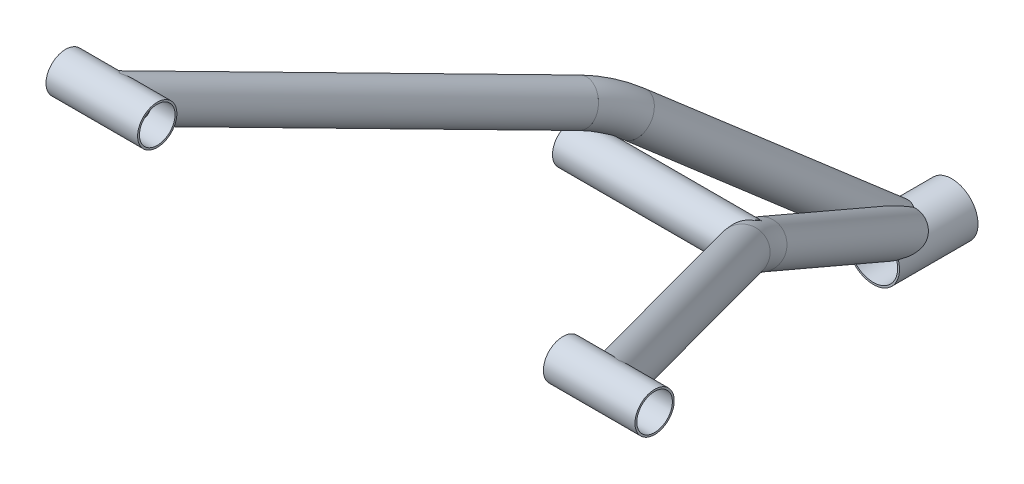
SolidWorks part; units mm, degrees
ref_plane "Front Plane" through (0, 0, 0) normal (0, 0, 1) x (1, 0, 0)
ref_plane "Top Plane" through (0, 0, 0) normal (0, 1, 0) x (1, 0, 0)
ref_plane "Right Plane" through (0, 0, 0) normal (1, 0, 0) x (0, 0, -1)
sketch "Sketch1" plane through (0, 0, 0) normal (0, 1, 0) x (1, 0, 0)
  line L0 (-142.875, 0) -> (142.875, 0) construction
  line L1 (-142.875, 0) -> (-98.425, 0)
  line L2 (142.875, 0) -> (98.425, 0)
  point P3 (120.65, 0)
  point P6 (-120.65, 0)
  dimension "D1" = 285.75
  dimension "D2" = 44.45
  dimension "D3" = 44.45
ref_plane "Plane1" through (0, 0, 0) normal (0, 0.8805, -0.4741) x (1, 0, 0)
sketch "Sketch2" plane through (0, 0, 0) normal (0, 0.8805, -0.4741) x (1, 0, 0)
  line L0 (-53.975, 0) -> (-53.975, 387.35) construction
  line L1 (-142.875, 1.1301) -> (-53.975, 1.1301) construction
  line L2 (-142.875, 0) -> (-142.875, 1.1301) construction
  line L3 (-12.7, 228.6) -> (120.65, 0)
  line L4 (-53.975, 0) -> (-53.975, 228.6) construction
  line L5 (-3.175, 228.6) -> (-98.425, 228.6)
  line L6 (142.875, 0) -> (98.425, 0) construction
  line L7 (-12.7, 228.6) -> (-98.425, 228.6)
  point P2 (-12.7, 228.6)
  dimension "D1" = 387.35
  dimension "D2" = 88.9
  dimension "D3" = 228.6
  dimension "D4" = 50.8
  dimension "D5" = 44.45
  dimension "D6" = 9.525
ref_plane "Plane2" through (0, -183.6381, 0) normal (0, 1, 0) x (1, 0, 0)
sketch "Sketch3" plane through (0, -183.6381, 0) normal (0, 1, 0) x (1, 0, 0)
  line L0 (-53.975, 341.0529) -> (-53.975, 302.9529)
  line L1 (-83.369, 322.0029) -> (-30.7181, 322.0029) construction
  point P3 (-53.975, 322.0029)
  dimension "D1" = 38.1
other "Structural Member1"
ref_plane "Plane3" through (-53.975, -183.6381, -341.0529) normal (0, 0, 1) x (1, 0, 0)
sketch "Sketch11" plane through (-53.975, -183.6381, -341.0529) normal (0, 0, 1) x (1, 0, 0)
  circle A0 centre (0, 0) radius 11.811
  circle A1 centre (0, 0) radius 12.7
  point P5 (0, 0)
  dimension "Out_dia" = 25.4
  dimension "D1" = 0.889
other "Structural Member2"
ref_plane "Plane4" through (142.875, 0, 0) normal (-1, 0, 0) x (0, 0, 1)
sketch "Sketch12" plane through (142.875, 0, 0) normal (-1, 0, 0) x (0, 0, 1)
  circle A0 centre (0, 0) radius 8.636
  circle A1 centre (0, 0) radius 9.525
  point P5 (0, 0)
  dimension "Out_dia" = 19.05
  dimension "D1" = 0.889
other "Structural Member3"
ref_plane "Plane5" through (-3.175, -108.3766, -201.2771) normal (-1, 0, 0) x (0, 0.4741, 0.8805)
sketch "Sketch13" plane through (-3.175, -108.3766, -201.2771) normal (-1, 0, 0) x (0, 0.4741, 0.8805)
  circle A0 centre (0, 0) radius 8.636
  circle A1 centre (0, 0) radius 9.525
  point P5 (0, 0)
  dimension "Out_dia" = 19.05
  dimension "D1" = 0.889
ref_plane "Plane6" through (0, -108.3766, -201.2771) normal (0, -0.4741, -0.8805) x (-1, 0, 0)
sketch "Sketch14" plane through (0, -108.3766, -201.2771) normal (0, -0.4741, -0.8805) x (-1, 0, 0)
  line L0 (53.975, 0) -> (53.975, 19.05) construction
  line L1 (3.175, 0) -> (98.425, 0) construction
  dimension "D1" = 19.05
ref_plane "Plane7" through (0, 0, 0) normal (0, 0.9168, -0.3993) x (1, 0, 0)
ref_plane "Plane8" through (0, 48.654, -40.0902) normal (0, -0.7718, 0.6359) x (-1, 0, 0)
sketch "Sketch15" plane through (0, 0, 0) normal (0, 0.9168, -0.3993) x (1, 0, 0)
  line L0 (-3.175, 227.8104) -> (-98.425, 227.8104) construction
  line L1 (-3.175, 227.8104) -> (-98.425, 227.8104) construction
  line L2 (-120.65, 0) -> (-88.9, 227.8104)
  point P3 (-88.9, 227.8104)
  point P4 (-12.7, 227.8104)
  dimension "D1" = 9.525
  dimension "D2" = 9.525
sketch "Sketch16" plane through (0, 48.654, -40.0902) normal (0, -0.7718, 0.6359) x (-1, 0, 0)
  line L0 (3.175, 219.0383) -> (98.425, 219.0383) construction
  line L1 (3.175, 219.0383) -> (98.425, 219.0383)
  line L3 (53.975, 365.2867) -> (88.9, 219.0383)
  point P0 (12.7, 219.0383)
  point P1 (88.9, 219.0383)
ref_plane "Plane9" through (0, 12.3152, -7.6774) normal (0, -0.8486, 0.529) x (-1, 0, 0)
sketch "Sketch18" plane through (0, 12.3152, -7.6774) normal (0, -0.8486, 0.529) x (-1, 0, 0)
  line L0 (12.7, 228.1389) -> (53.975, 370.4028)
sketch3d "3DSketch1"
  line L0 (120.65, 0, 0) -> (-7.0148, -103.7561, -192.696)
  line L1 (-15.8439, -114.1092, -210.4727) -> (-53.975, -183.6381, -322.0029)
  line L2 (-53.975, -183.6381, -322.0029) -> (-85.8688, -98.7079, -218.9305)
  line L3 (-90.7004, -85.4965, -197.2753) -> (-120.65, 0, 0)
  arc A0 (-7.0148, -103.7561, -192.696) -> (-15.8439, -114.1092, -210.4727) centre (67.453, -143.454, -220.6572) ccw
  arc A1 (-90.7004, -85.4965, -197.2753) -> (-85.8688, -98.7079, -218.9305) centre (-59.727, -160.1365, -160.225) ccw
  point P12 (-12.7, -108.3766, -201.2771)
  point P13 (48.7115, -214.1785, -170.1595)
  point P16 (-88.9, -90.6362, -209.1346)
  point P17 (-142.1492, -193.3957, -158.324)
  dimension "D1" = 88.9
other "Structural Member4"
ref_plane "Plane11" through (-7.0148, -103.7561, -192.696) normal (-0.5039, -0.4095, -0.7605) x (-0.0602, -0.8617, 0.5039)
sketch "Sketch19" plane through (-7.0148, -103.7561, -192.696) normal (-0.5039, -0.4095, -0.7605) x (-0.0602, -0.8617, 0.5039)
  circle A0 centre (0, 0) radius 8.636
  circle A1 centre (0, 0) radius 9.525
  point P5 (0, 0)
  dimension "Out_dia" = 19.05
  dimension "D1" = 0.889
other "Structural Member5"
ref_plane "Plane12" through (-90.7004, -85.4965, -197.2753) normal (0.138, -0.3938, -0.9088) x (0.7914, 0.5956, -0.138)
sketch "Sketch110" plane through (-90.7004, -85.4965, -197.2753) normal (0.138, -0.3938, -0.9088) x (0.7914, 0.5956, -0.138)
  circle A0 centre (0, 0) radius 8.636
  circle A1 centre (0, 0) radius 9.525
  point P5 (0, 0)
  dimension "Out_dia" = 19.05
  dimension "D1" = 0.889
other "Structural Member6"
ref_plane "Plane13" through (-90.7004, -85.4965, -197.2753) normal (-0.138, 0.3938, 0.9088) x (-0.9873, -0.1272, -0.0948)
sketch "Sketch111" plane through (-90.7004, -85.4965, -197.2753) normal (-0.138, 0.3938, 0.9088) x (-0.9873, -0.1272, -0.0948)
  circle A0 centre (0, 0) radius 8.636
  circle A1 centre (0, 0) radius 9.525
  point P5 (0, 0)
  dimension "Out_dia" = 19.05
  dimension "D1" = 0.889
delete or keep bodies "Body-Delete/Keep 1" type delete bodies bodies 104
other "Structural Member7"
ref_plane "Plane14" through (-12.7, -108.3766, -201.2771) normal (-1, 0, 0) x (0, 0.4741, 0.8805)
sketch "Sketch112" plane through (-12.7, -108.3766, -201.2771) normal (-1, 0, 0) x (0, 0.4741, 0.8805)
  circle A0 centre (0, 0) radius 8.636
  circle A1 centre (0, 0) radius 9.525
  point P5 (0, 0)
  dimension "Out_dia" = 19.05
  dimension "D1" = 0.889
sketch "Sketch113" plane through (0, 0, -341.0529) normal (0, 0, -1) x (-1, 0, 0)
  circle A0 centre (53.975, -183.6381) radius 11.811 construction
  circle A1 centre (53.975, -183.6381) radius 11.811
extrude "Cut-Extrude1" cut sketch "Sketch113" against normal through all
sketch "Sketch114" plane through (0, 0, -341.0529) normal (0, 0, -1) x (-1, 0, 0)
  circle A0 centre (53.975, -183.6381) radius 44.5906
extrude "Cut-Extrude2" cut sketch "Sketch114" along normal blind 25.4 contours A0
sketch "Sketch115" plane through (0, 0, -341.0529) normal (0, 0, -1) x (-1, 0, 0)
  line L0 (51.3821, -196.0706) -> (57.15, -206.4874)
  line L1 (57.15, -206.4874) -> (62.2632, -205.5131)
  line L2 (62.2632, -205.5131) -> (61.6897, -193.7263)
  arc A0 (61.6897, -193.7263) -> (51.3821, -196.0706) centre (53.975, -183.6381) cw
  circle A1 centre (53.975, -183.6381) radius 12.7 construction
extrude "Cut-Extrude3" cut sketch "Sketch115" against normal blind 25.4
sketch "Sketch116" plane through (142.875, 0, 0) normal (1, 0, 0) x (0, 0, -1)
  circle A0 centre (0, 0) radius 8.636 construction
  circle A1 centre (0, 0) radius 8.636
extrude "Cut-Extrude4" cut sketch "Sketch116" against normal through all
sketch "Sketch117" plane through (0, 0, -341.0529) normal (0, 0, -1) x (-1, 0, 0)
  circle A0 centre (53.975, -183.6381) radius 11.811 construction
  circle A1 centre (53.975, -183.6381) radius 11.811
extrude "Cut-Extrude5" cut sketch "Sketch117" against normal through all
sketch "Sketch118" plane through (0, 0, -341.0529) normal (0, 0, -1) x (-1, 0, 0)
  circle A0 centre (53.975, -183.6381) radius 12.7 construction
  circle A1 centre (53.975, -183.6381) radius 12.7
extrude "Cut-Extrude6" cut sketch "Sketch118" along normal blind 25.4
sketch "Sketch119" plane through (0, 0, -341.0529) normal (0, 0, -1) x (-1, 0, 0)
  line L0 (53.4058, -196.3253) -> (52.077, -206.4689)
  line L1 (52.077, -206.4689) -> (60.7412, -206.9412)
  line L2 (60.7412, -206.9412) -> (65.1105, -199.3745)
  line L3 (65.1105, -199.3745) -> (62.2809, -193.2455)
  arc A0 (62.2809, -193.2455) -> (53.4058, -196.3253) centre (53.975, -183.6381) cw
  circle A1 centre (53.975, -183.6381) radius 12.7 construction
extrude "Cut-Extrude7" cut sketch "Sketch119" against normal through all both and the other way through all
sketch "Sketch120" plane through (0, 0, -341.0529) normal (0, 0, -1) x (-1, 0, 0)
  line L0 (46.0391, -193.5533) -> (42.5401, -202.8566)
  line L1 (42.5401, -202.8566) -> (54.7494, -210.7877)
  line L2 (54.7494, -210.7877) -> (62.1957, -206.0769)
  line L3 (62.1957, -206.0769) -> (60.86, -201.381)
  line L4 (60.86, -201.381) -> (57.521, -195.833)
  arc A0 (46.0391, -193.5533) -> (57.521, -195.833) centre (53.975, -183.6381) ccw
  circle A2 centre (53.975, -183.6381) radius 12.7 construction
extrude "Cut-Extrude9" cut sketch "Sketch120" against normal blind 25.4 contours L1 L2 L3 L4 A0 L0
ref_plane "Plane15" through (254, 0, 0) normal (1, 0, 0) x (0, 0, -1)
